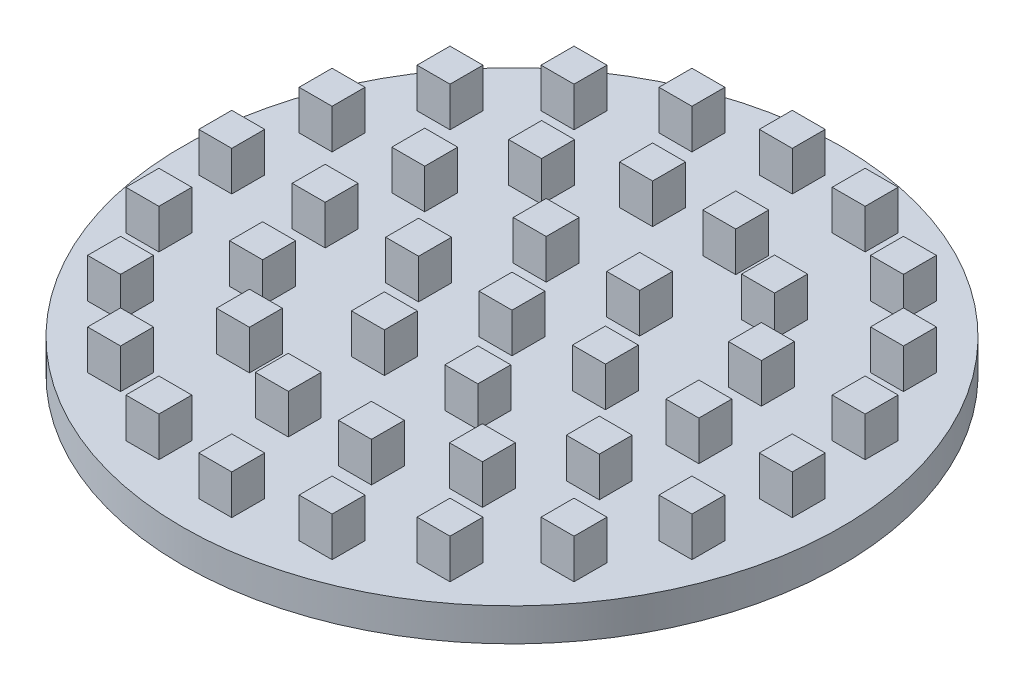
SolidWorks part; units mm, degrees
ref_plane "Front Plane" through (0, 0, 0) normal (0, 0, 1) x (1, 0, 0)
ref_plane "Top Plane" through (0, 0, 0) normal (0, 1, 0) x (1, 0, 0)
ref_plane "Right Plane" through (0, 0, 0) normal (1, 0, 0) x (0, 0, -1)
sketch "Sketch1" plane through (0, 0, 0) normal (0, 1, 0) x (1, 0, 0)
  circle A0 centre (0, 0) radius 127
  dimension "D1" = 254
extrude "Extrude1" add sketch "Sketch1" along normal blind 12.7
sketch "Sketch2" plane through (0, 12.7, 0) normal (0, 1, 0) x (1, 0, 0)
  line L1 (-6.35, 6.35) -> (6.35, 6.35)
  line L2 (-6.35, 6.35) -> (-6.35, -6.35)
  line L3 (-6.35, -6.35) -> (6.35, -6.35)
  line L4 (6.35, 6.35) -> (6.35, -6.35)
  dimension "D1" = 12.7
  dimension "D2" = 12.7
  dimension "D3" = 6.35
  dimension "D4" = 6.35
extrude "Extrude2" add sketch "Sketch2" along normal blind 15.24
other "Fill Pattern4" parameters "D5"=0, "D6"=0, "D4"=36, "D9"=41, "D3"=0, "D7"=4, "D8"=20
